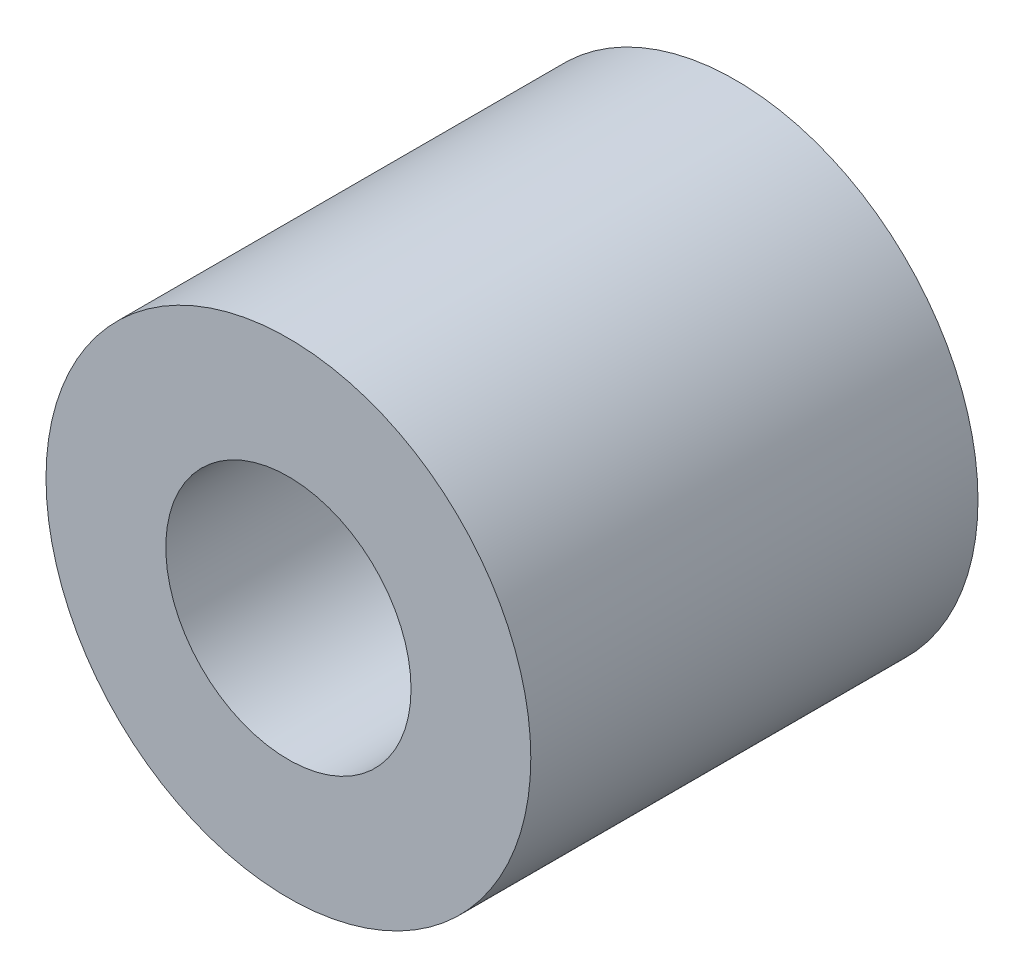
SolidWorks part; units mm, degrees
ref_plane "Plan de face" through (0, 0, 0) normal (0, 0, 1) x (1, 0, 0)
ref_plane "Plan de dessus" through (0, 0, 0) normal (0, 1, 0) x (1, 0, 0)
ref_plane "Plan de droite" through (0, 0, 0) normal (1, 0, 0) x (0, 0, -1)
sketch "Esquisse1" plane through (0, 0, 0) normal (0, 0, 1) x (1, 0, 0)
  circle A0 centre (0, 0) radius 31.9829
  circle A1 centre (0, 0) radius 16.1787
extrude "Boss.-Extru.1" add sketch "Esquisse1" along normal blind 59
sketch "Esquisse2" plane through (0, 0, 59) normal (0, 0, 1) x (1, 0, 0)
  circle A0 centre (-23.3448, -3.9163) radius 4.9632
sketch "Esquisse3" plane through (0, 0, 59) normal (0, 0, 1) x (1, 0, 0)
  circle A0 centre (0, 0) radius 16.1787 construction
  circle A1 centre (0, 0) radius 16.1787
